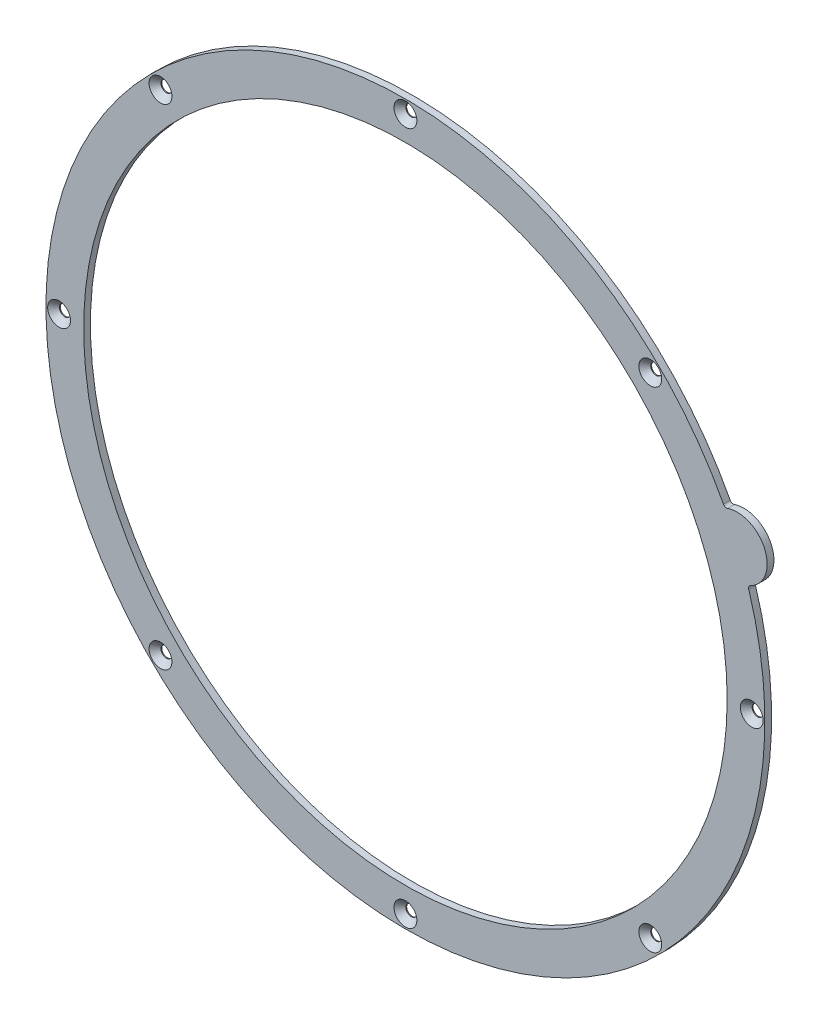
SolidWorks part; units mm, degrees
ref_plane "Plan de face" through (0, 0, 0) normal (0, 0, 1) x (1, 0, 0)
ref_plane "Plan de dessus" through (0, 0, 0) normal (0, 1, 0) x (1, 0, 0)
ref_plane "Plan de droite" through (0, 0, 0) normal (1, 0, 0) x (0, 0, -1)
sketch "Esquisse1" plane through (0, 0, 0) normal (0, 0, 1) x (1, 0, 0)
  circle A0 centre (0, 0) radius 190
  circle A1 centre (0, 0) radius 212.25
  dimension "D1" = 424.5
  dimension "D2" = 380
extrude "Extrusion1" add sketch "Esquisse1" along normal blind 4
sketch "Esquisse2" plane through (0, 0, 4) normal (0, 0, 1) x (1, 0, 0)
  circle A0 centre (0, 0) radius 204.5 construction
  circle A1 centre (0, 204.5) radius 3.25
  dimension "D1" = 409
  dimension "D2" = 6.5
extrude "Extrusion2" cut sketch "Esquisse2" against normal through all
chamfer "Chanfrein2" distance 3.5 angle 45 1 edges at (3.25, 204.5, 4)
pattern_circular "Répétition circulaire1" count 8 over 360 about axis through (0, 0, 0) along (0, 0, 1) of "Extrusion2", "Chanfrein2"
sketch "Esquisse3" plane through (0, 0, 4) normal (0, 0, 1) x (1, 0, 0)
  line L0 (0, 0) -> (195.8625, 81.1289) construction
  line L1 (0, 0) -> (80.2731, 0) construction
  circle A0 centre (195.8625, 81.1289) radius 17.75
  circle A1 centre (0, 0) radius 190 construction
  dimension "D2" = 35.5
  dimension "D3" = 212
  dimension "D1" = 22.5
extrude "Extrusion3" add sketch "Esquisse3" against normal up to surface (4 mm away)
fillet "Congé1" radius 2 2 edges at (202.1971, 64.5477, 2) (188.617, 97.3328, 2)
